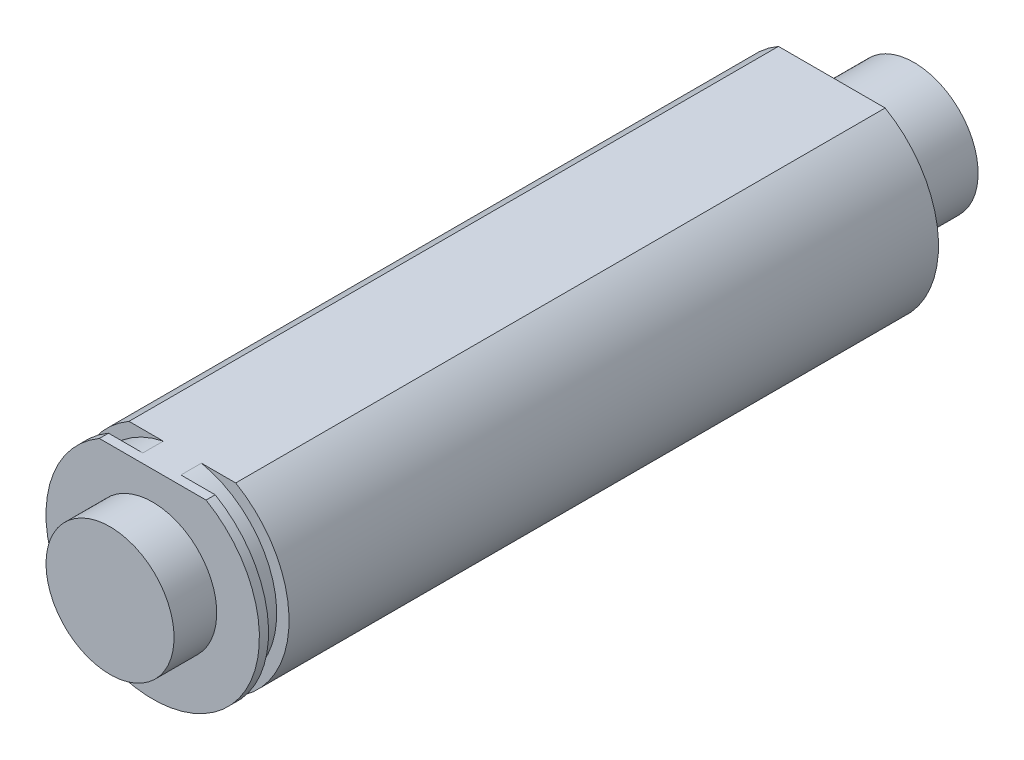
SolidWorks part; units mm, degrees
ref_plane "Front Plane" through (0, 0, 0) normal (0, 0, 1) x (1, 0, 0)
ref_plane "Top Plane" through (0, 0, 0) normal (0, 1, 0) x (1, 0, 0)
ref_plane "Right Plane" through (0, 0, 0) normal (1, 0, 0) x (0, 0, -1)
sketch "Sketch1" plane through (0, 0, 0) normal (0, 0, 1) x (1, 0, 0)
  circle A1 centre (0, 0) radius 7.9375 construction
sketch "Sketch2" plane through (0, 0, 0) normal (1, 0, 0) x (0, 0, -1)
  line L0 (-152.4, 7.9375) -> (152.4, 7.9375) construction
  line L1 (0, 7.9375) -> (0, -7.9375) construction
  line L2 (0, 7.9375) -> (0, -7.9375) construction
  point P2 (0, 7.9375)
  point P3 (120.65, 7.9375)
  point P4 (-120.65, 7.9375)
sketch "Sketch3" plane through (0, 0, 0) normal (0, 0, 1) x (1, 0, 0)
  circle A1 centre (0, 0) radius 7.9375 construction
  circle A3 centre (0, 0) radius 7.9375
extrude "Boss-Extrude2" add sketch "Sketch3" along normal up to vertex (152.4 mm away) and the other way up to vertex (152.4 mm away)
sketch "Sketch10" plane through (0, 0, 0) normal (0, 0, 1) x (1, 0, 0)
  line L0 (-3.9688, 6.8741) -> (3.9688, 6.8741)
  line L1 (0, 0) -> (0, 7.9375) construction
  circle A0 centre (0, 0) radius 7.9375 construction
  circle A1 centre (0, 0) radius 7.9375 construction
  arc A2 (-3.9688, 6.8741) -> (3.9688, 6.8741) centre (0, 0) cw
extrude "Cut-Extrude5" cut sketch "Sketch10" against normal through all both and the other way through all
chamfer "Chamfer1" distance 0.7937 angle 45 4 edges at (0, -7.9375, 152.4) (0, -7.9375, -152.4) (0, 6.8741, -152.4) (0, 6.8741, 152.4)
sketch "Sketch15" plane through (0, 0, 0) normal (0, 1, 0) x (1, 0, 0)
  line L2 (-7.9375, -152.4) -> (0, -152.4)
  line L3 (0, -152.4) -> (0, 82.8825)
  line L4 (0, 0) -> (0, -223.4962) construction
  line L5 (-1.9443, -152.4) -> (1.9443, -152.4) construction
  line L6 (-7.9375, 151.6062) -> (-7.9375, -151.6063) construction
  line L7 (-7.9375, 151.6062) -> (-7.9375, -151.6063) construction
  line L8 (-7.9375, 86.0575) -> (-7.9375, -152.4)
  line L9 (-7.9375, 86.0575) -> (-4.7625, 86.0575)
  line L10 (-4.7625, 86.0575) -> (-4.7625, 82.8825)
  line L11 (-4.7625, 82.8825) -> (0, 82.8825)
  dimension "D1" = 4.7625
  dimension "D2" = 238.4575
  dimension "D3" = 3.175
revolve "Cut-Revolve1" cut sketch "Sketch15" angle 360 about L4
sketch "Sketch16" plane through (0, 6.8741, 0) normal (0, 1, 0) x (1, 0, 0)
  line L1 (-24.3605, 172.0874) -> (24.2759, 172.0874)
  line L2 (-24.3605, 172.0874) -> (-24.3605, 140.1536)
  line L3 (-24.3605, 140.1536) -> (24.2759, 140.1536)
  line L4 (24.2759, 172.0874) -> (24.2759, 140.1536)
  point P4 (0, 0)
  dimension "D1" = 140.1536
extrude "Cut-Extrude7" cut sketch "Sketch16" against normal through all contours L3 L4 L1 L2
sketch "Sketch17" plane through (0, 0, -140.1536) normal (0, 0, -1) x (-1, 0, 0)
  line L1 (-13.1558, 8.9507) -> (17.3657, 8.9507)
  line L2 (-13.1558, 8.9507) -> (-13.1558, -10.5951)
  line L3 (-13.1558, -10.5951) -> (17.3657, -10.5951)
  line L4 (17.3657, 8.9507) -> (17.3657, -10.5951)
  circle A0 centre (0, 0) radius 4.7625
  dimension "D1" = 9.525
extrude "Cut-Extrude8" cut sketch "Sketch17" against normal blind 3.5814 contours L1 L4 L3 L2 | A0
sketch "Sketch18" plane through (0, 0, 0) normal (0, 1, 0) x (1, 0, 0)
  line L0 (-7.9375, 136.5722) -> (-7.9375, 86.0575) construction
  line L1 (-7.9375, 86.7379) -> (-7.0188, 86.7379)
  line L2 (-7.9375, 86.7379) -> (-7.9375, 88.2619)
  line L3 (-7.9375, 88.2619) -> (-7.0188, 88.2619)
  line L4 (-7.0188, 86.7379) -> (-7.0188, 88.2619)
  line L6 (0, 83.9307) -> (0, 120.4257) construction
  line L7 (-7.9375, 86.0575) -> (7.9375, 86.0575) construction
  dimension "D1" = 1.524
  dimension "D2" = 0.6804
revolve "Cut-Revolve2" cut sketch "Sketch18" angle 360 about L6
sketch "Sketch19" plane through (0, 0, -140.1536) normal (0, 0, -1) x (-1, 0, 0)
  circle A0 centre (0, 0) radius 4.7625
extrude "Boss-Extrude3" add sketch "Sketch19" along normal blind 2.54
equation "\"D1@Chamfer1\"= \"Diameter@Sketch1\" / 20"
equation "\"D1@Sketch2\"=\"Diameter@Sketch1\"*2"
equation "\"D2@Sketch2\"=\"D1@Sketch2\""
